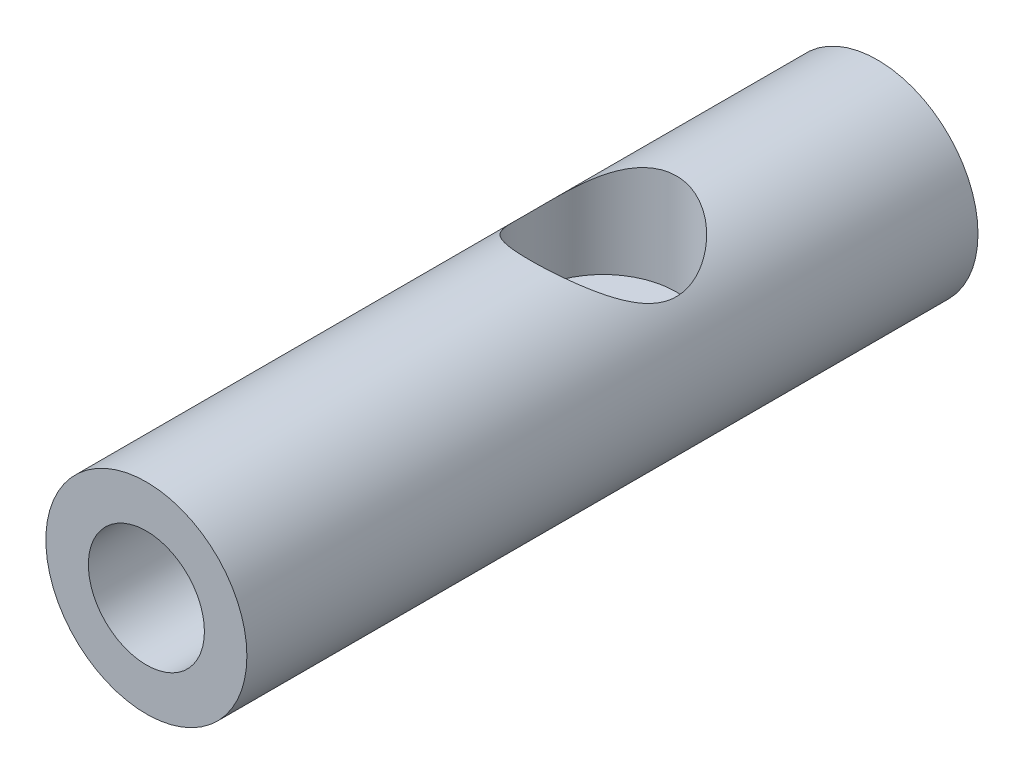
SolidWorks part; units mm, degrees
ref_plane "Front Plane" through (0, 0, 0) normal (0, 0, 1) x (1, 0, 0)
ref_plane "Top Plane" through (0, 0, 0) normal (0, 1, 0) x (1, 0, 0)
ref_plane "Right Plane" through (0, 0, 0) normal (1, 0, 0) x (0, 0, -1)
sketch "Sketch1" plane through (0, 0, 0) normal (0, 0, 1) x (1, 0, 0)
  circle A0 centre (0, 0) radius 5.5
  dimension "D1" = 11
extrude "Boss-Extrude1" add sketch "Sketch1" along normal mid plane 40
sketch "Sketch2" plane through (0, 0, 0) normal (0, 1, 0) x (1, 0, 0)
  line L0 (0, 0) -> (0, 5) construction
  circle A0 centre (0, 5) radius 4
  dimension "D1" = 8
  dimension "D2" = 5
extrude "Cut-Extrude1" cut sketch "Sketch2" along normal through all
sketch "Sketch3" plane through (0, 0, 20) normal (0, 0, 1) x (1, 0, 0)
  circle A0 centre (0, 0) radius 3.175
  dimension "D1" = 6.35
extrude "Cut-Extrude2" cut sketch "Sketch3" against normal blind 5.7
sketch "Sketch4" plane through (0, 0, -20) normal (0, 0, -1) x (-1, 0, 0)
  circle A0 centre (0, 0) radius 3.2
  dimension "D1" = 6.4
extrude "Cut-Extrude3" cut sketch "Sketch4" against normal blind 3
